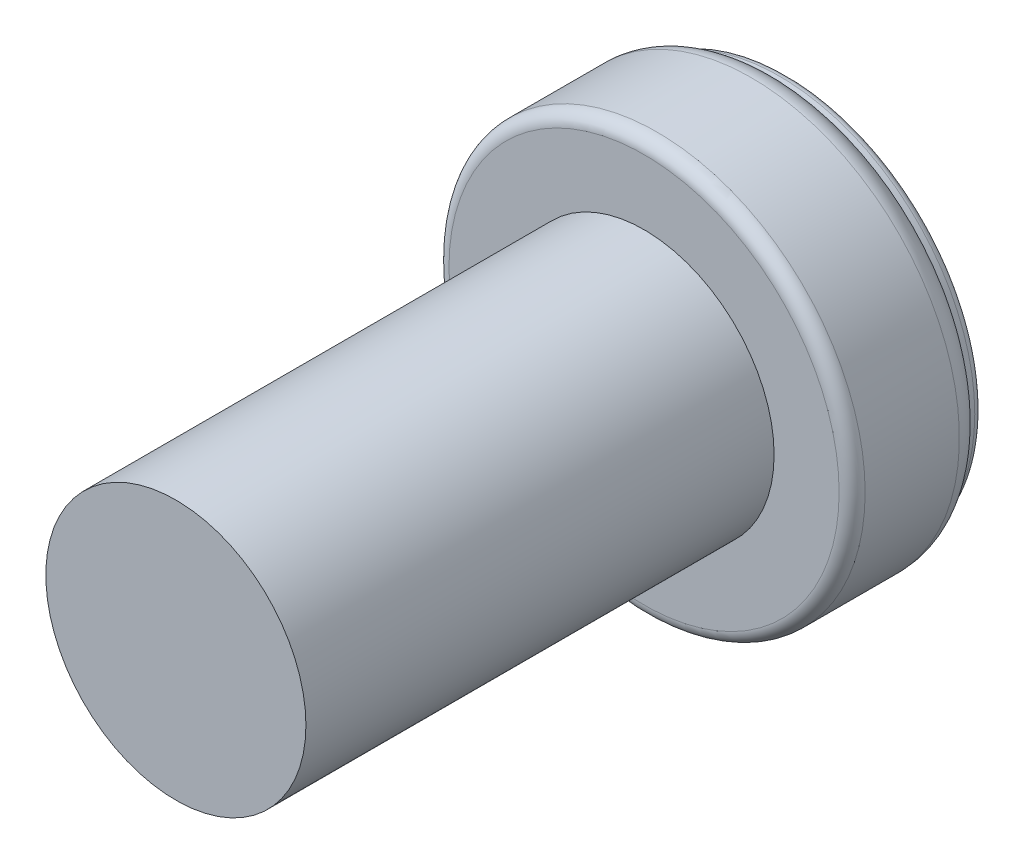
SolidWorks part; units mm, degrees
ref_plane "Спереди" through (0, 0, 0) normal (0, 0, 1) x (1, 0, 0)
ref_plane "Сверху" through (0, 0, 0) normal (0, 1, 0) x (1, 0, 0)
ref_plane "Справа" through (0, 0, 0) normal (1, 0, 0) x (0, 0, -1)
sketch "Эскиз1" plane through (0, 0, 0) normal (0, 0, 1) x (1, 0, 0)
  circle A0 centre (0.0802, -0.2405) radius 8
  dimension "D1" = 16
extrude "Бобышка-Вытянуть1" add sketch "Эскиз1" along normal blind 4.9897
sketch "Эскиз5" plane through (0, 0, 0) normal (0, 0, -1) x (-1, 0, 0)
  circle A0 centre (-0.0802, -0.2405) radius 7.5
  circle A1 centre (-0.0802, -0.2405) radius 8 construction
  dimension "D2" = 15
  dimension "D1" = 0
extrude "Бобышка-Вытянуть2" add sketch "Эскиз5" along normal blind 0.5255
sketch "Эскиз7" plane through (0, 0, -0.5255) normal (0, 0, -1) x (-1, 0, 0)
  circle A0 centre (-0.0802, -0.2405) radius 6.5
  circle A1 centre (-0.0802, -0.2405) radius 7.5 construction
  dimension "D1" = 13
  dimension "D2" = 0
extrude "Вырез-Вытянуть2" cut sketch "Эскиз7" against normal blind 1
fillet "Скругление1" radius 0.3 1 edges at (-7.4198, -0.2405, -0.5255)
fillet "Скругление2" radius 0.3 1 edges at (-6.4198, -0.2405, -0.5255)
sketch "Эскиз8" plane through (0, 0, 0.4745) normal (0, 0, -1) x (-1, 0, 0)
  circle A0 centre (-0.0802, -0.2405) radius 5.5
  circle A1 centre (-0.0802, -0.2405) radius 8 construction
  dimension "D2" = 11
  dimension "D1" = 0
extrude "Бобышка-Вытянуть3" add sketch "Эскиз8" along normal blind 1
sketch "Эскиз9" plane through (0, 0, -0.5255) normal (0, 0, -1) x (-1, 0, 0)
  circle A0 centre (-0.0802, -0.1352) radius 4.5
  circle A1 centre (-0.0802, -0.2405) radius 8 construction
  dimension "D2" = 9
  dimension "D1" = 0
extrude "Вырез-Вытянуть3" cut sketch "Эскиз9" against normal blind 0.7612
fillet "Скругление3" radius 0.3 2 edges at (-4.4198, -0.1352, -0.5255) (-5.4198, -0.2405, -0.5255)
sketch "Эскиз10" plane through (0, 0, 0.2358) normal (0, 0, -1) x (-1, 0, 0)
  circle A0 centre (-0.0802, -0.2405) radius 3.5
  circle A1 centre (-0.0802, -0.2405) radius 8 construction
  dimension "D2" = 7
  dimension "D1" = 0
extrude "Бобышка-Вытянуть4" add sketch "Эскиз10" along normal blind 1
sketch "Эскиз11" plane through (0, 0, -0.7642) normal (0, 0, -1) x (-1, 0, 0)
  circle A0 centre (-0.0802, -0.2405) radius 2.5
  circle A1 centre (-0.0802, -0.2405) radius 8 construction
  dimension "D2" = 5
  dimension "D1" = 0
extrude "Вырез-Вытянуть4" cut sketch "Эскиз11" against normal blind 0.2911
fillet "Скругление4" radius 0.3 2 edges at (-2.4198, -0.2405, -0.7642) (-3.4198, -0.2405, -0.7642)
sketch "Эскиз14" plane through (0, 0, 4.9897) normal (0, 0, 1) x (1, 0, 0)
  circle A0 centre (0.0802, -0.2405) radius 5
  circle A1 centre (0.0802, -0.2405) radius 8 construction
  dimension "D2" = 10
  dimension "D1" = 0
extrude "Бобышка-Вытянуть5" add sketch "Эскиз14" along normal blind 18
fillet "Скругление6" radius 1 1 edges at (8.0802, -0.2405, 0)
fillet "Скругление7" radius 0.5 1 edges at (8.0802, -0.2405, 4.9897)
